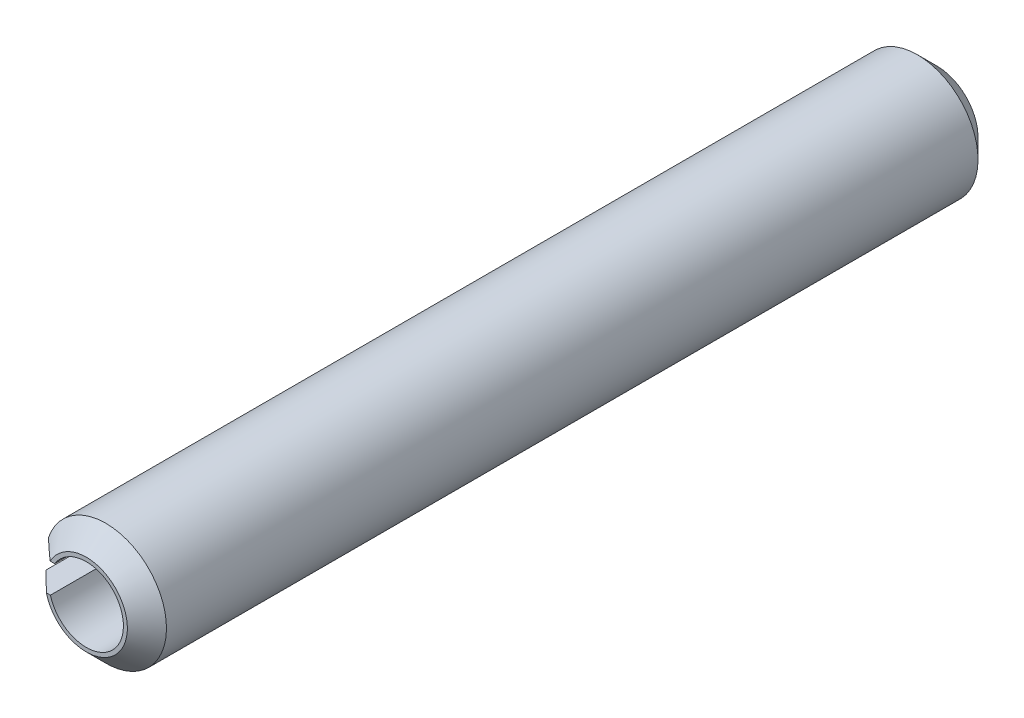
SolidWorks part; units mm, degrees
ref_plane "Front Plane" through (0, 0, 0) normal (0, 0, 1) x (1, 0, 0)
ref_plane "Top Plane" through (0, 0, 0) normal (0, 1, 0) x (1, 0, 0)
ref_plane "Right Plane" through (0, 0, 0) normal (1, 0, 0) x (0, 0, -1)
sketch "Sketch1" plane through (0, 0, 0) normal (0, 0, 1) x (1, 0, 0)
  line L0 (0, 0) -> (-1.5875, 0) construction
  line L1 (-0.4103, 0.254) -> (-0.7453, 0.254)
  line L2 (-0.4656, -0.127) -> (-0.7771, -0.127)
  line L3 (0, 0.254) -> (-2.2739, 0.254) construction
  line L4 (0, -0.127) -> (-2.2739, -0.127) construction
  line L5 (0, 0) -> (-2.2739, 0) construction
  arc A0 (-0.7771, -0.127) -> (-0.7453, 0.254) centre (0, 0) ccw
  arc A1 (-0.4656, -0.127) -> (-0.4103, 0.254) centre (0, 0) ccw
  circle A2 centre (0, 0) radius 0.4826 construction
  circle A3 centre (0, 0) radius 0.7874 construction
  dimension "D1" = 1.5748
  dimension "D2" = 0.3048
  dimension "D3" = 0.254
  dimension "D4" = 0.127
extrude "Boss-Extrude1" add sketch "Sketch1" along normal mid plane 11.049
chamfer "Chamfer2" distance 0.254 angle 45 2 edges at (0.7847, -0.0655, -5.5245) (0.7847, -0.0655, 5.5245)
